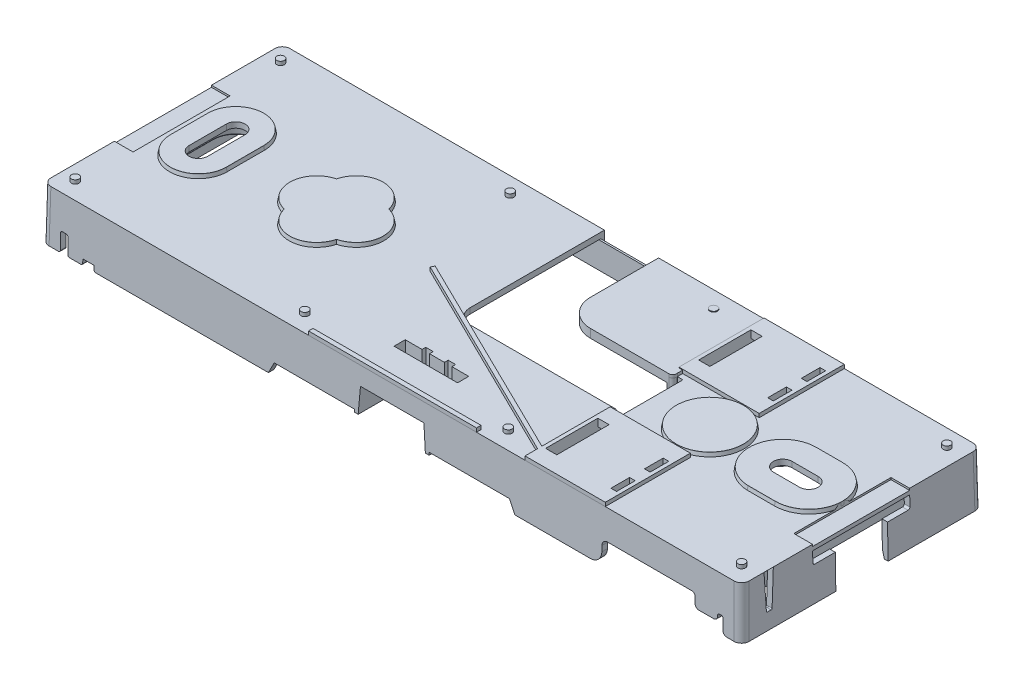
SolidWorks part; units mm, degrees
ref_plane "Plan de face" through (0, 0, 0) normal (0, 0, 1) x (1, 0, 0)
ref_plane "Plan de dessus" through (0, 0, 0) normal (0, 1, 0) x (1, 0, 0)
ref_plane "Plan de droite" through (0, 0, 0) normal (1, 0, 0) x (0, 0, -1)
sketch "Esquisse1" plane through (0, 0, 0) normal (0, 1, 0) x (1, 0, 0)
  line L1 (-93.75, 32.25) -> (93.75, 32.25)
  line L2 (-93.75, 32.25) -> (-93.75, -32.25)
  line L3 (-93.75, -32.25) -> (93.75, -32.25)
  line L4 (93.75, 32.25) -> (93.75, -32.25)
  dimension "D1" = 187.5
  dimension "D2" = 93.75
  dimension "D3" = 64.5
  dimension "D4" = 32.25
extrude "Extrusion1" add sketch "Esquisse1" along normal blind 13.8
draft "Dépouille2" type of draft neutral plane draft angle 1 faces to draft 2 parameters "D1"=1
draft "Dépouille4" type of draft neutral plane draft angle 1 faces to draft 2 parameters "D1"=1
fillet "Congé1" radius 2
fillet "Congé2" radius 2
fillet "Congé3" radius 2
fillet "Congé4" radius 2
shell "Coque4" thickness 1.5
sketch "Esquisse2" plane through (0, 0, 0) normal (1, 0, 0) x (0, 0, -1)
  line L0 (0, 21.9085) -> (0, -7.1737) construction
  line L1 (-13, 12.3) -> (13, 12.3)
  line L2 (-30.0352, 12.3) -> (30.0352, 12.3) construction
  line L4 (-13, 12.3) -> (-13, 9)
  line L5 (-13, 9) -> (-7, 9)
  line L6 (-7, 9) -> (-7, 0)
  line L7 (-30.2503, 0) -> (30.2503, 0) construction
  line L8 (13, 12.3) -> (13, 9)
  line L9 (13, 9) -> (7, 9)
  line L10 (7, 9) -> (7, 0)
  line L11 (-7, 0) -> (7, 0)
  dimension "D1" = 26
  dimension "D2" = 13
  dimension "D3" = 14
  dimension "D4" = 7
  dimension "D5" = 9
  dimension "D6" = 9
extrude "Enlèv. mat.-Extru.1" cut sketch "Esquisse2" against normal mid plane 200
sketch "Esquisse3" plane through (93.7214, 1.6359, 0) normal (0.9998, 0.0175, 0) x (0, 0, -1)
  line L0 (-26.0091, 12.1659) -> (-25.5091, 2.6659)
  line L1 (-30.0094, 12.1659) -> (30.0094, 12.1659) construction
  line L2 (-25.5091, 2.6659) -> (-24.0091, 2.6659)
  line L3 (-24.0091, 2.6659) -> (-23.5091, 12.1659)
  line L4 (-26.0091, 12.1659) -> (-23.5091, 12.1659)
  dimension "D1" = 6
  dimension "D2" = 2.5
  dimension "D3" = 1.5
  dimension "D4" = 9.5
  dimension "D5" = 0.5
extrude "Enlèv. mat.-Extru.2" cut sketch "Esquisse3" against normal blind 1.5
fillet "Congé5" radius 0.25
fillet "Congé6" radius 0.25
sketch "Esquisse4" plane through (-93.7214, 1.6359, 0) normal (-0.9998, 0.0175, 0) x (0, 0, 1)
  line L0 (26.0092, 12.1659) -> (25.5092, 2.6659)
  line L2 (-30.0094, 12.1659) -> (30.0094, 12.1659) construction
  line L6 (25.5092, 2.6659) -> (24.0092, 2.6659)
  line L7 (24.0092, 2.6659) -> (23.5092, 12.1659)
  line L8 (23.5092, 12.1659) -> (26.0092, 12.1659)
  dimension "D1" = 6
  dimension "D2" = 0.5
  dimension "D3" = 9.5
  dimension "D4" = 1.5
  dimension "D5" = 2.5
extrude "Enlèv. mat.-Extru.3" cut sketch "Esquisse4" against normal blind 1.5
fillet "Congé7" radius 0.25
fillet "Congé8" radius 0.25
sketch "Esquisse5" plane through (0, 0, 0) normal (0, 0, 1) x (1, 0, 0)
  line L0 (88.75, 0) -> (88.75, 4.3)
  line L1 (-91.7503, 0) -> (91.7503, 0) construction
  line L2 (88.75, 4.3) -> (87.25, 4.3)
  line L3 (87.25, 4.3) -> (87.25, 2.5)
  line L4 (87.25, 2.5) -> (81.25, 2.5)
  line L5 (81.25, 2.5) -> (81.25, 6)
  line L6 (81.25, 6) -> (56.25, 6)
  line L7 (56.25, 6) -> (56.25, 0)
  line L8 (-91.5094, 13.8) -> (91.5094, 13.8) construction
  dimension "D1" = 5
  dimension "D2" = 1.5
  dimension "D3" = 6
  dimension "D4" = 25
  dimension "D5" = 7.8
  dimension "D6" = 11.3
  dimension "D7" = 4.3
extrude "Enlèv. mat.-Extru.4" cut sketch "Esquisse5" against normal through all and the other way through all
fillet "Congé9" radius 3
fillet "Congé10" radius 3
fillet "Congé11" radius 1.5
fillet "Congé12" radius 1.5
fillet "Congé13" radius 1
fillet "Congé14" radius 1
fillet "Congé15" radius 1
fillet "Congé16" radius 1
fillet "Congé17" radius 1
fillet "Congé18" radius 1
fillet "Congé19" radius 1
fillet "Congé20" radius 1
fillet "Congé21" radius 0.5
fillet "Congé22" radius 0.5
sketch "Esquisse6" plane through (0, 0, 0) normal (0, 0, 1) x (1, 0, 0)
  line L0 (0, -4.4225) -> (0, 25.4688) construction
  line L1 (-8.5, 9) -> (8.5, 9)
  line L2 (-91.5094, 13.8) -> (91.5094, 13.8) construction
  line L3 (-10, 2.3) -> (-9, 2.3)
  line L4 (-8.5, 9) -> (-9, 2.3)
  line L5 (8.5, 9) -> (9, 2.3)
  line L6 (9, 2.3) -> (10, 2.3)
  line L7 (10, 2.3) -> (10, 3)
  line L8 (10, 3) -> (31.5, 3)
  line L9 (31.5, 3) -> (33, 0)
  line L10 (-91.7503, 0) -> (53.25, 0) construction
  line L11 (-10, 2.3) -> (-10, 3)
  line L12 (-10, 3) -> (-31.5, 3)
  line L13 (-31.5, 3) -> (-33, 0)
  line L14 (-33, 0) -> (33, 0)
  dimension "D1" = 17
  dimension "D2" = 8.5
  dimension "D3" = 4.8
  dimension "D4" = 11.5
  dimension "D5" = 9
  dimension "D6" = 1
  dimension "D7" = 1
  dimension "D8" = 9
  dimension "D9" = 11.5
  dimension "D10" = 10.8
  dimension "D11" = 21.5
  dimension "D12" = 1.5
  dimension "D13" = 10.8
  dimension "D14" = 21.5
  dimension "D15" = 1.5
extrude "Enlèv. mat.-Extru.5" cut sketch "Esquisse6" along normal blind 42.5
sketch "Esquisse8" plane through (0, 0, 0) normal (0, 0, 1) x (1, 0, 0)
  line L0 (-88.75, 0) -> (-88.75, 5)
  line L1 (-91.7503, 0) -> (-33, 0) construction
  line L2 (-88.75, 5) -> (-86.75, 5)
  line L3 (-86.75, 5) -> (-86.75, 0)
  line L4 (-82.75, 0) -> (-82.75, 1.5)
  line L5 (-82.75, 1.5) -> (-79.75, 1.5)
  line L6 (-79.75, 1.5) -> (-79.75, 0)
  line L7 (-86.75, 0) -> (-82.75, 0)
  line L8 (-88.75, 0) -> (-84.2317, -2.6338)
  line L9 (-84.2317, -2.6338) -> (-79.75, 0)
  dimension "D1" = 5
  dimension "D2" = 2
  dimension "D3" = 2
  dimension "D4" = 5
  dimension "D5" = 4
  dimension "D6" = 3
  dimension "D7" = 5
  dimension "D8" = 1.5
extrude "Enlèv. mat.-Extru.7" cut sketch "Esquisse8" against normal mid plane 200 contours L0 L2 L3 L7 L4 L5 L6 L9 L8
fillet "Congé23" radius 0.5
fillet "Congé24" radius 0.5
sketch "Esquisse9" plane through (0, 0, 0) normal (0, 0, 1) x (1, 0, 0)
  line L0 (-36.75, 0) -> (-35.25, 7.3)
  line L1 (-79.25, 0) -> (-33, 0) construction
  line L2 (-35.25, 7.3) -> (-32.25, 7.3)
  line L3 (-32.25, 7.3) -> (-32.25, 5.1)
  line L4 (-32.25, 5.1) -> (32.75, 5.1)
  line L5 (32.75, 5.1) -> (32.75, 6.1)
  line L6 (32.75, 6.1) -> (39.75, 6.1)
  line L7 (39.75, 6.1) -> (39.75, 0)
  line L8 (33, 0) -> (53.25, 0) construction
  line L9 (-91.5094, 13.8) -> (91.5094, 13.8) construction
  line L10 (-36.75, 0) -> (39.75, 0)
  dimension "D1" = 57
  dimension "D2" = 1.5
  dimension "D3" = 3
  dimension "D4" = 65
  dimension "D5" = 7
  dimension "D6" = 8.7
  dimension "D7" = 6.5
  dimension "D8" = 1
extrude "Enlèv. mat.-Extru.8" cut sketch "Esquisse9" against normal blind 200
sketch "Esquisse10" plane through (0, 0, 0) normal (0, 0, 1) x (1, 0, 0)
  line L0 (0, -4.4225) -> (0, 26.6766) construction
  line L1 (-91.5352, 12.3) -> (91.5352, 12.3) construction
  line L2 (-88.25, 12.3) -> (-87.25, 12.3)
  line L3 (-88.25, 12.3) -> (-88.25, 5)
  line L4 (-88.25, 5) -> (-87.25, 5)
  line L5 (-87.25, 12.3) -> (-87.25, 5)
  line L6 (88.25, 12.3) -> (87.25, 12.3)
  line L7 (87.25, 12.3) -> (87.25, 5)
  line L8 (88.25, 12.3) -> (88.25, 5)
  line L9 (88.25, 5) -> (87.25, 5)
  dimension "D1" = 1
  dimension "D2" = 7.3
  dimension "D3" = 7.3
  dimension "D4" = 88.25
extrude "Extrusion2" add sketch "Esquisse10" along normal mid plane 63
fillet "Congé25" radius 0.5
fillet "Congé26" radius 0.5
sketch "Esquisse11" plane through (0, 0, 0) normal (0, 0, 1) x (1, 0, 0)
  line L0 (0, 0) -> (0, 35.4326) construction
  line L1 (-87.25, 12.3) -> (87.25, 12.3) construction
  line L2 (-35.4, 12.3) -> (-34.2, 12.3)
  line L3 (-35.4, 12.3) -> (-35.4, 6.3)
  line L4 (-35.4, 6.3) -> (-34.2, 6.3)
  line L5 (-34.2, 12.3) -> (-34.2, 6.3)
  dimension "D1" = 1.2
  dimension "D2" = 24.2
  dimension "D3" = 6
  dimension "D4" = 6
extrude "Extrusion3" add sketch "Esquisse11" along normal mid plane 63
sketch "Esquisse12" plane through (0, 0, 0) normal (0, 0, 1) x (1, 0, 0)
  line L0 (0, 0) -> (0, 31.5075) construction
  line L1 (10, 3) -> (10, 2.3) construction
  line L2 (35, 12.3) -> (36.5, 12.3)
  line L3 (35, 12.3) -> (35, 0)
  line L4 (35, 0) -> (36.5, 0)
  line L5 (36.5, 12.3) -> (36.5, 0)
  line L6 (-34.2, 12.3) -> (87.25, 12.3) construction
  dimension "D1" = 25
  dimension "D2" = 1.5
  dimension "D3" = 12.3
  dimension "D4" = 12.3
extrude "Extrusion4" add sketch "Esquisse12" along normal mid plane 63
sketch "Esquisse13" plane through (-34.2, 0, 0) normal (1, 0, 0) x (0, 0, -1)
  line L0 (31.5, 7.3) -> (18.1223, 7.3)
  line L1 (18.1223, 7.3) -> (18.1223, 8.8)
  line L2 (18.1223, 8.8) -> (8.6416, 8.8)
  line L4 (-30.6398, 6.3) -> (31.5, 6.3) construction
  line L5 (8.6416, 8.8) -> (8.6416, 3.9431)
  line L6 (30.6608, 5.1) -> (30.6223, 7.3) construction
  line L7 (8.6416, 3.9431) -> (31.5, 3.9431)
  line L8 (31.5, 3.9431) -> (31.5, 7.3)
  point P8 (30.6416, 6.2)
  dimension "D1" = 2.5
  dimension "D2" = 12.5
  dimension "D3" = 22
extrude "Enlèv. mat.-Extru.11" cut sketch "Esquisse13" against normal blind 1.2
fillet "Congé27" radius 0.5
fillet "Congé28" radius 1
sketch "Esquisse15" plane through (0, 13.8, 0) normal (0, 1, 0) x (-1, 0, 0)
  line L0 (-104.5219, 0) -> (103.7404, 0) construction
  line L1 (0, -45.7161) -> (0, 65.2529) construction
  line L2 (-101.7867, 27.5) -> (100.6145, 27.5) construction
  line L3 (-89.0091, 17.4132) -> (-89.0091, 39.1061) construction
  line L6 (-93.5091, 23.5091) -> (-93.5091, -30.0094) construction
  line L7 (-26.5091, 19.7772) -> (-26.5091, 34.5172) construction
  line L8 (27.9909, 19.7772) -> (27.9909, 36.3249) construction
  line L9 (89.4909, 17.4132) -> (89.4909, 39.1061) construction
  circle A0 centre (-89.0091, 27.5) radius 1
  circle A1 centre (-26.5091, 27.5) radius 1
  circle A2 centre (27.9909, 27.5) radius 1
  circle A3 centre (89.4909, 27.5) radius 1
  circle A4 centre (-89.0091, -27.5) radius 1
  circle A5 centre (-26.5091, -27.5) radius 1
  circle A6 centre (27.9909, -27.5) radius 1
  circle A7 centre (89.4909, -27.5) radius 1
  dimension "D6" = 2
  dimension "D7" = 2
  dimension "D8" = 2
  dimension "D9" = 2
  dimension "D1" = 27.5
  dimension "D2" = 4.5
  dimension "D3" = 62.5
  dimension "D4" = 54.5
  dimension "D5" = 61.5
extrude "Extrusion6" add sketch "Esquisse15" along normal blind 1
sketch "Esquisse16" plane through (0, 13.8, 0) normal (0, 1, 0) x (-1, 0, 0)
  line L0 (0, -44.5439) -> (0, 38.6829) construction
  line L1 (-7.25, -35.1017) -> (-7.25, 3.2822) construction
  line L2 (7.25, -37.3832) -> (7.25, 14.69) construction
  line L3 (5.7803, 0) -> (-47.7692, 0) construction
  line L4 (-47.7692, -6.5351) -> (-9.5195, -6.5351) construction
  line L5 (-48.7086, 7.9649) -> (13.1619, 7.9649) construction
  line L6 (-35, -30.5351) -> (34.2, -30.5351) construction
  line L7 (-7.25, -32.0091) -> (-7.25, -6.5351)
  line L8 (-91.5094, -32.0091) -> (91.5094, -32.0091) construction
  line L9 (-7.25, -32.0091) -> (7.25, -32.0091)
  line L10 (7.25, -32.0091) -> (7.25, 7.9649)
  line L11 (-36.5, -17.3861) -> (-36.5, 15.6294) construction
  line L12 (-36.5, 30.5351) -> (-36.5, -30.5351) construction
  line L13 (-7.25, -6.5351) -> (-35, -6.5351)
  line L14 (-35, 30.5351) -> (-35, -30.5351) construction
  line L15 (-35, -6.5351) -> (-35, 7.9649)
  line L20 (-35, 7.9649) -> (7.25, 7.9649)
  dimension "D1" = 14.5
  dimension "D2" = 7.25
  dimension "D3" = 14.5
  dimension "D4" = 24
extrude "Enlèv. mat.-Extru.13" cut sketch "Esquisse16" against normal blind 1.5
sketch "Esquisse17" plane through (36.5, 0, 0) normal (1, 0, 0) x (0, 0, -1)
  line L0 (-7.9649, 13.05) -> (-7.9649, -2.8307) construction
  line L1 (-7.9649, 12.3) -> (-7.9649, 13.8) construction
  line L2 (6.5351, 13.05) -> (6.5351, -5.635) construction
  line L3 (6.5351, 12.3) -> (6.5351, 13.8) construction
  line L4 (-14.3333, 8.25) -> (14.2295, 8.25) construction
  line L5 (7, 0) -> (30.2503, 0) construction
  line L6 (-11.4251, 1) -> (11.0097, 1) construction
  line L7 (-7.9649, 8.25) -> (-7.9649, 12.3)
  line L8 (-7.9649, 12.3) -> (6.5351, 12.3)
  line L10 (6.5351, 12.3) -> (6.5351, 8.25)
  arc A0 (-7.9649, 8.25) -> (6.5351, 8.25) centre (-0.7149, 8.25) ccw
  dimension "D2" = 1
  dimension "D3" = 7.25
  dimension "D1" = 8.25
extrude "Enlèv. mat.-Extru.16" cut sketch "Esquisse17" against normal blind 2 contours A0 L10 L8 L7
sketch "Esquisse18" plane through (0, 12.3, 0) normal (0, -1, 0) x (1, 0, 0)
  line L0 (38, 10.4091) -> (38, -9.0348) construction
  line L1 (38, 9.2149) -> (38, -7.7851)
  line L2 (38, -7.7851) -> (36.5, -7.7851)
  line L3 (36.5, 30.7498) -> (36.5, -31.5) construction
  line L4 (36.5, -7.7851) -> (36.5, -6.5351)
  line L5 (36.5, -6.5351) -> (35, -6.5351)
  line L6 (35, -6.5351) -> (35, 7.9649)
  line L7 (35, 7.9649) -> (36.5, 7.9649)
  line L8 (38, 9.2149) -> (36.5, 9.2149)
  line L9 (36.5, 9.2149) -> (36.5, 7.9649)
  dimension "D1" = 17
  dimension "D2" = 1.25
  dimension "D3" = 1.5
extrude "Enlèv. mat.-Extru.17" cut sketch "Esquisse18" against normal blind 2
fillet "Congé29" radius 4
fillet "Congé30" radius 7.25
fillet "Congé31" radius 1
sketch "Esquisse19" plane through (0, 13.8, 0) normal (0, 1, 0) x (-1, 0, 0)
  line L0 (91.5094, 32.0091) -> (-91.5094, 32.0091) construction
  line L1 (-57, 9.2149) -> (-35.5, 9.2149)
  line L2 (-57, 9.2149) -> (-57, 32.0091)
  line L3 (-57, 32.0091) -> (-35.5, 32.0091)
  line L4 (-35.5, 9.2149) -> (-35.5, 32.0091)
  line L5 (-37.0326, 9.2149) -> (-39.783, 9.2149) construction
  line L6 (-36.5, 9.2149) -> (-38, 9.2149) construction
  line L7 (-36.5, 8.9649) -> (-36.5, 0.7149) construction
  line L8 (-7.6194, 0) -> (-99.4423, 0) construction
  line L9 (-57, -32.0091) -> (-35.5, -32.0091)
  line L10 (-35.5, -9.2149) -> (-35.5, -32.0091)
  line L11 (-57, -9.2149) -> (-57, -32.0091)
  line L12 (-57, -9.2149) -> (-35.5, -9.2149)
  dimension "D1" = 22.7942
  dimension "D2" = 21.5
  dimension "D3" = 1
extrude "Extrusion7" add sketch "Esquisse19" along normal blind 1
sketch "Esquisse20" plane through (0, 13.8, 0) normal (0, 1, 0) x (-1, 0, 0)
  line L0 (0, 0) -> (-76.3289, 0) construction
  line L1 (-53, -19.72) -> (-53, 18.6881) construction
  line L2 (-38, 9.2149) -> (-38, -7.7851) construction
  circle A0 centre (-53, 0) radius 9
  dimension "D2" = 18
  dimension "D1" = 15
extrude "Extrusion8" add sketch "Esquisse20" along normal blind 1
sketch "Esquisse21" plane through (0, 14.8, 0) normal (0, 1, 0) x (-1, 0, 0)
  line L0 (0, 0) -> (-84.2036, 0) construction
  line L1 (-36.5, -7.7851) -> (-36.5, -30.5351) construction
  line L2 (-39.5, -27.5) -> (-36.5, -27.5)
  line L3 (-39.5, -27.5) -> (-39.5, -13.5)
  line L4 (-39.5, -13.5) -> (-36.5, -13.5)
  line L5 (-36.5, -27.5) -> (-36.5, -13.5)
  line L6 (-39.5, 13.5) -> (-36.5, 13.5)
  line L7 (-39.5, 27.5) -> (-39.5, 13.5)
  line L8 (-36.5, 27.5) -> (-36.5, 13.5)
  line L9 (-39.5, 27.5) -> (-36.5, 27.5)
  dimension "D1" = 14
  dimension "D2" = 3
  dimension "D3" = 13.5
  dimension "D4" = 3
extrude "Enlèv. mat.-Extru.18" cut sketch "Esquisse21" against normal through all
sketch "Esquisse22" plane through (0, 14.8, 0) normal (0, 1, 0) x (-1, 0, 0)
  line L0 (-68.7483, 0) -> (-25.6869, 0) construction
  line L1 (-57, -9.2149) -> (-57, -32.0091) construction
  line L2 (-56, -28) -> (-54.5, -28)
  line L3 (-56, -28) -> (-56, -23)
  line L4 (-56, -23) -> (-54.5, -23)
  line L5 (-54.5, -28) -> (-54.5, -23)
  line L6 (-56, -19) -> (-54.5, -19)
  line L7 (-56, -19) -> (-56, -14)
  line L8 (-56, -14) -> (-54.5, -14)
  line L9 (-54.5, -19) -> (-54.5, -14)
  line L10 (-56, 14) -> (-54.5, 14)
  line L11 (-54.5, 19) -> (-54.5, 14)
  line L12 (-56, 19) -> (-56, 14)
  line L13 (-56, 19) -> (-54.5, 19)
  line L14 (-56, 23) -> (-54.5, 23)
  line L15 (-54.5, 28) -> (-54.5, 23)
  line L16 (-56, 28) -> (-56, 23)
  line L17 (-56, 28) -> (-54.5, 28)
  dimension "D1" = 14
  dimension "D2" = 5
  dimension "D3" = 4
  dimension "D4" = 5
  dimension "D5" = 1.5
  dimension "D6" = 1.5
  dimension "D7" = 1
  dimension "D8" = 1
extrude "Enlèv. mat.-Extru.19" cut sketch "Esquisse22" against normal through all
fillet "Congé34" radius 3
sketch "Esquisse23" plane through (36.5, 0, 0) normal (1, 0, 0) x (0, 0, -1)
  line L0 (0, 0) -> (0, 16.676) construction
  line L1 (-0.7149, 0) -> (31.5, 0) construction
  line L2 (28, 0) -> (13, 0)
  line L3 (28, 0) -> (28, 4)
  line L4 (28, 4) -> (13, 4)
  line L5 (13, 0) -> (13, 4)
  line L6 (-13, 0) -> (-13, 4)
  line L7 (-28, 4) -> (-13, 4)
  line L8 (-28, 0) -> (-13, 0)
  line L9 (-28, 0) -> (-28, 4)
  dimension "D1" = 13
  dimension "D2" = 28
  dimension "D3" = 4
  dimension "D4" = 4
extrude "Extrusion9" add sketch "Esquisse23" along normal blind 3
sketch "Esquisse24" plane through (0, 0, -28) normal (0, 0, -1) x (-1, 0, 0)
  line L0 (-36.5, 0) -> (-39.5, 2.5)
  line L1 (-39.5, 0) -> (-39.5, 4) construction
  line L2 (-39.5, 2.5) -> (-39.5, 0)
  line L3 (-39.5, 0) -> (-36.5, 0)
  line L4 (-36.5, 4) -> (-39.5, 3)
  line L5 (-39.5, 3) -> (-39.5, 4)
  line L6 (-39.5, 4) -> (-36.5, 4)
  dimension "D1" = 2.5
  dimension "D2" = 1
extrude "Enlèv. mat.-Extru.20" cut sketch "Esquisse24" against normal blind 57
sketch "Esquisse25" plane through (35, 0, 0) normal (-1, 0, 0) x (0, 0, 1)
  line L0 (34.1431, 1.5) -> (-33.4306, 1.5) construction
  line L1 (30.7498, 0) -> (-31.5, 0) construction
  line L2 (29.4523, 10) -> (-28.3937, 10) construction
  line L3 (13.125, -3.2449) -> (13.125, 12.3) construction
  line L4 (30.5351, 12.3) -> (7.9649, 12.3) construction
  line L5 (-13.125, -4.0437) -> (-13.125, 12.3) construction
  line L6 (-28.25, -4.0437) -> (-28.25, 11.2653) construction
  line L7 (28.25, -4.0437) -> (28.25, 11.2653) construction
  line L8 (0, 0) -> (0, 15.8873) construction
  line L9 (-32.063, 5.3169) -> (-26.7317, 5.3169) construction
  line L10 (13.625, 10) -> (12.625, 10)
  line L11 (12.625, 10) -> (12.375, 1.5)
  line L12 (13.625, 10) -> (13.875, 0)
  line L13 (12.375, 1.5) -> (5.4583, 1.5)
  line L14 (29, 1.5) -> (28.5, 10)
  line L15 (28.5, 10) -> (27.5, 10)
  line L16 (27.5, 10) -> (27.5, 0)
  line L17 (29, 1.5) -> (30.6947, 1.5)
  line L18 (30.6947, 1.5) -> (30.6947, -1.7229)
  line L19 (27.5, 0) -> (13.875, 0)
  line L20 (-12.375, 1.5) -> (-12.625, 10)
  line L21 (-12.625, 10) -> (-13.625, 10)
  line L22 (-13.625, 10) -> (-13.875, 0)
  line L24 (-4.0285, 1.5) -> (-12.375, 1.5)
  line L25 (-27.5, 0) -> (-27.75, 10)
  line L26 (-27.75, 10) -> (-28.75, 10)
  line L27 (-13.875, 0) -> (-27.5, 0)
  line L28 (-30.6433, 6.1) -> (-25.0711, 6.1) construction
  line L29 (-28.75, 10) -> (-29, 6.1)
  line L30 (-29, 6.1) -> (-34.8945, 6.1)
  line L31 (-34.8945, 6.1) -> (-34.8945, -2.896)
  line L32 (-34.8945, -2.896) -> (30.6947, -1.7229)
  arc A0 (5.4583, 1.5) -> (-4.0285, 1.5) centre (0.7149, 8.25) cw
  dimension "D15" = 8.25
  dimension "D1" = 1.5
  dimension "D2" = 10
  dimension "D3" = 26.25
  dimension "D4" = 13.125
  dimension "D5" = 56.5
  dimension "D6" = 28.25
  dimension "D7" = 0.5
  dimension "D8" = 1
  dimension "D9" = 0.75
  dimension "D10" = 0.75
  dimension "D11" = 0.5
  dimension "D12" = 1
  dimension "D13" = 0.75
  dimension "D14" = 0.75
  dimension "D16" = 0.5
  dimension "D17" = 1
  dimension "D18" = 0.75
  dimension "D19" = 0.75
  dimension "D20" = 0.5
  dimension "D21" = 0.5
  dimension "D22" = 0.75
  dimension "D23" = 0.75
extrude "Enlèv. mat.-Extru.21" cut sketch "Esquisse25" against normal blind 4.5
fillet "Congé35" radius 0.5
fillet "Congé36" radius 0.5
sketch "Esquisse26" plane through (36.5, 0, 0) normal (1, 0, 0) x (0, 0, -1)
  line L1 (0, 0) -> (0, 20.1944) construction
  line L2 (-13.5, 12.3) -> (-9.2149, 12.3) construction
  line L3 (-9.2149, 1.5) -> (-10.4149, 1.5)
  line L4 (-9.2149, 1.5) -> (-9.2149, 12.3)
  line L6 (-9.2149, 12.3) -> (-10.4149, 12.3)
  line L9 (-10.4149, 1.5) -> (-10.4149, 12.3)
  line L10 (9.2149, 1.5) -> (10.4149, 1.5)
  line L11 (10.4149, 1.5) -> (10.4149, 12.3)
  line L12 (9.2149, 1.5) -> (9.2149, 12.3)
  line L13 (9.2149, 12.3) -> (10.4149, 12.3)
  dimension "D1" = 1.2
  dimension "D2" = 10.8
  dimension "D3" = 10.8
  dimension "D4" = 1.2
extrude "Extrusion10" add sketch "Esquisse26" along normal blind 10.3
fillet "Congé37" radius 3
sketch "Esquisse28" plane through (0, 12.3, 0) normal (0, -1, 0) x (1, 0, 0)
  line L0 (0, 0) -> (82.6407, 0) construction
  line L1 (82.6407, 0) -> (22.4673, 0) construction
  line L2 (52.9447, -4.2981) -> (52.9447, 4.2981) construction
  circle A1 centre (52.9447, 0) radius 7.25
  dimension "D1" = 14.5
extrude "Enlèv. mat.-Extru.23" cut sketch "Esquisse28" against normal blind 1
sketch "Esquisse29" plane through (0, 12.3, 0) normal (0, -1, 0) x (1, 0, 0)
  line L0 (0, 0) -> (75.589, 0) construction
  line L1 (56, 19) -> (56, 14) construction
  line L2 (58, 30.5351) -> (56.5, 30.5351)
  line L3 (58, 30.5351) -> (58, 10.5351)
  line L4 (58, 10.5351) -> (56.5, 10.5351)
  line L5 (56.5, 30.5351) -> (56.5, 10.5351)
  line L6 (36.5, 30.5351) -> (87.25, 30.5351) construction
  line L7 (58, -10.5351) -> (56.5, -10.5351)
  line L8 (56.5, -30.5351) -> (56.5, -10.5351)
  line L9 (58, -30.5351) -> (58, -10.5351)
  line L10 (58, -30.5351) -> (56.5, -30.5351)
  dimension "D1" = 1.5
  dimension "D2" = 0.5
  dimension "D3" = 20
  dimension "D4" = 20
extrude "Extrusion11" add sketch "Esquisse29" along normal blind 4
sketch "Esquisse31" plane through (0, 13.8, 0) normal (0, 1, 0) x (-1, 0, 0)
  line L0 (0, -45.3254) -> (0, 58.6104) construction
  line L1 (0, 0) -> (104.5219, 0) construction
  line L2 (93.5091, -30.0094) -> (93.5091, 23.5092) construction
  line L3 (88.5091, -13) -> (98.5091, -13)
  line L4 (88.5091, -13) -> (88.5091, 13)
  line L5 (88.5091, 13) -> (98.5091, 13)
  line L6 (98.5091, -13) -> (98.5091, 13)
  line L7 (-88.5091, 13) -> (-98.5091, 13)
  line L8 (-98.5091, -13) -> (-98.5091, 13)
  line L9 (-88.5091, -13) -> (-88.5091, 13)
  line L10 (-88.5091, -13) -> (-98.5091, -13)
  dimension "D1" = 26
  dimension "D2" = 13
  dimension "D3" = 5
  dimension "D4" = 10
extrude "Enlèv. mat.-Extru.25" cut sketch "Esquisse31" against normal blind 0.5
sketch "Esquisse32" plane through (0, 13.8, 0) normal (0, 1, 0) x (-1, 0, 0)
  line L0 (-36.5, -7.7851) -> (-36.5, -9.2149)
  line L1 (-36.5, -9.2149) -> (-35.5, -9.2149)
  line L2 (-35.5, -9.2149) -> (-35.5, -32.0091)
  line L3 (-35.5, -32.0091) -> (-7.25, -32.0091)
  line L4 (-14.5, -6.5351) -> (-35.5, -6.5351)
  line L5 (-7.25, -13.7851) -> (-7.25, -32.0091)
  arc A0 (-36.5, -7.7851) -> (-35.5, -6.5351) centre (-35.5, -7.5601) cw
  arc A1 (-7.25, -13.7851) -> (-14.5, -6.5351) centre (-14.5, -13.7851) ccw
extrude "Extrusion12" add sketch "Esquisse32" along normal blind 0.8
sketch "Esquisse33" plane through (0, 13.8, 0) normal (0, 1, 0) x (-1, 0, 0)
  line L0 (0, 0) -> (34.2, 0) construction
  line L1 (34.2, 30.5351) -> (34.2, -30.5351) construction
  line L2 (-38, 27.5) -> (-29.8854, 27.5) construction
  line L3 (-36.5, 27.5) -> (-39.5, 27.5) construction
  line L4 (10.7301, 0.0091) -> (24.0665, 0.0091) construction
  line L5 (91.5094, 32.0091) -> (-35.5, 32.0091) construction
  line L6 (-35.5, 27.5) -> (20.5798, 0)
  line L7 (-35.5, 9.2149) -> (-35.5, 32.0091) construction
  line L8 (20.5798, 0) -> (21.0486, 0.8833)
  line L9 (21.0486, 0.8833) -> (-35.5, 28.6508)
  line L10 (-35.5, 27.5) -> (-35.5, 28.6508)
  dimension "D1" = 32
  dimension "D2" = 1
  dimension "D3" = 62.4596
  dimension "D4" = 62.9983
  dimension "D5" = 0.8833
extrude "Extrusion13" add sketch "Esquisse33" along normal blind 1
sketch "Esquisse34" plane through (0, 13.8, 0) normal (0, 1, 0) x (-1, 0, 0)
  line L0 (0, 0) -> (0, 53.1401) construction
  line L1 (91.5094, 32.0091) -> (-35.5, 32.0091) construction
  line L2 (-22.5, 30.8091) -> (22.5, 30.8091)
  line L3 (-22.5, 30.8091) -> (-22.5, 32.0091)
  line L4 (-22.5, 32.0091) -> (22.5, 32.0091)
  line L5 (22.5, 30.8091) -> (22.5, 32.0091)
  dimension "D1" = 45
  dimension "D2" = 22.5
  dimension "D3" = 1.2
  dimension "D4" = 1.2
extrude "Extrusion14" add sketch "Esquisse34" along normal blind 1
sketch "Esquisse35" plane through (0, 13.8, 0) normal (0, 1, 0) x (-1, 0, 0)
  line L0 (0, 0) -> (96.2898, 0) construction
  line L1 (79.0091, -25.9426) -> (79.0091, 26.7309) construction
  line L2 (93.5091, 13) -> (93.5091, 23.5092) construction
  line L3 (71.5091, -5) -> (71.5091, 5)
  line L4 (86.5091, -5) -> (86.5091, 5)
  arc A0 (71.5091, -5) -> (86.5091, -5) centre (79.0091, -5) ccw
  arc A1 (71.5091, 5) -> (86.5091, 5) centre (79.0091, 5) cw
  dimension "D6" = 7.5
  dimension "D7" = 7.5
  dimension "D1" = 14.5
  dimension "D2" = 10
  dimension "D3" = 5
  dimension "D4" = 7.5
  dimension "D5" = 15
  dimension "D8" = 10
  dimension "D9" = 10
extrude "Extrusion15" add sketch "Esquisse35" along normal blind 1
sketch "Esquisse36" plane through (0, 13.8, 0) normal (0, 1, 0) x (-1, 0, 0)
  line L0 (0, 0) -> (103.7404, 0) construction
  line L1 (40.0091, -14.8018) -> (40.0091, 16.6481) construction
  line L2 (34.5091, -6.7269) -> (34.5091, 6.7315) construction
  line L4 (54.0091, -14.8018) -> (54.0091, 16.6481) construction
  line L5 (59.5091, -5.7352) -> (59.5091, 5.3148) construction
  line L6 (33.122, -7) -> (62.7303, -7) construction
  line L7 (33.122, 7) -> (60.6053, 7) construction
  line L8 (42.4719, 12.5) -> (53.6636, 12.5) construction
  line L9 (37.9386, -12.5) -> (53.6636, -12.5) construction
  line L10 (93.5091, 13) -> (93.5091, 23.5092) construction
  arc A0 (40.0091, -7) -> (54.0091, -7) centre (47.0091, -5.2955) ccw
  arc A1 (40.0091, -7) -> (40.0091, 7) centre (41.7137, 0) cw
  arc A2 (40.0091, 7) -> (54.0091, 7) centre (47.0091, 5.2955) cw
  arc A3 (54.0091, 7) -> (54.0091, -7) centre (52.3046, 0) cw
  point P19 (93.5091, 18.2546)
  dimension "D9" = 7.2045
  dimension "D10" = 7.2045
  dimension "D1" = 14
  dimension "D2" = 14
  dimension "D3" = 7
  dimension "D4" = 25
  dimension "D5" = 12.5
  dimension "D6" = 34
  dimension "D7" = 25
  dimension "D8" = 5.5
extrude "Extrusion16" add sketch "Esquisse36" along normal blind 1
chamfer "Chanfrein1" distance 0.2 angle 78
chamfer "Chanfrein2" distance 0.2 angle 78
chamfer "Chanfrein3" distance 0.2 angle 78
chamfer "Chanfrein4" distance 0.2 angle 78
sketch "Esquisse37" plane through (0, 13.8, 0) normal (0, 1, 0) x (-1, 0, 0)
  line L0 (0, 0) -> (-102.9589, 0) construction
  line L1 (-79.5178, -9) -> (-72.5178, -9)
  line L2 (-79.5178, 9) -> (-72.2328, 9)
  line L3 (-93.5178, 13) -> (-93.5178, -13) construction
  arc A0 (-79.5178, -9) -> (-79.5178, 9) centre (-79.5178, 0) cw
  arc A1 (-72.5178, -9) -> (-72.2328, 9) centre (-72.5178, 0.0023) ccw
  dimension "D5" = 9.0023
  dimension "D1" = 7
  dimension "D2" = 18
  dimension "D3" = 9
  dimension "D4" = 14
extrude "Extrusion17" add sketch "Esquisse37" along normal blind 1
chamfer "Chanfrein5" distance 0.2 angle 78
sketch "Esquisse38" plane through (0, 12.3, 0) normal (0, -1, 0) x (1, 0, 0)
  line L0 (0, 0) -> (-94.2888, 0) construction
  line L1 (-35.4, -30.5351) -> (-87.25, 30.5351) construction
  line L2 (-35.4, 30.5351) -> (-87.25, -30.5351) construction
  line L7 (-84.9808, -28.6344) -> (-34.7138, 30.5351) construction
  line L8 (-34.7138, 30.5351) -> (-87.0662, -31.1136)
  line L9 (-85.7251, -27.9665) -> (-35.4, 31.3226) construction
  line L10 (-34.7138, 30.5351) -> (-35.4, 31.3226)
  line L11 (-35.4, 31.3226) -> (-87.9298, -30.5351)
  line L12 (-87.9298, -30.5351) -> (-87.0662, -31.1136)
  line L13 (-85.3901, 29.117) -> (-34.7138, -30.5351) construction
  line L14 (-36.7868, -29.6742) -> (-87.9298, 30.5351) construction
  dimension "D2" = 0.5
  dimension "D7" = 1
  dimension "D8" = 0.5
extrude "Extrusion18" add sketch "Esquisse38" along normal blind 4
sketch "Esquisse39" plane through (0, 12.3, 0) normal (0, -1, 0) x (1, 0, 0)
  line L0 (-35.4, -30.5351) -> (-87.25, 30.5351) construction
  line L3 (-36.7074, -28.2227) -> (-87.7001, 31.8348) construction
  line L4 (-87.1285, 31.1616) -> (-34.744, -30.5351)
  line L5 (-37.4813, -28.8559) -> (-88.0994, 30.7436) construction
  line L6 (-87.1285, 31.1616) -> (-88.0994, 30.7436)
  line L7 (-88.0994, 30.7436) -> (-35.5144, -31.1892)
  line L8 (-35.5144, -31.1892) -> (-34.744, -30.5351)
  dimension "D3" = 1
  dimension "D4" = 0.5
extrude "Extrusion19" add sketch "Esquisse39" along normal blind 4
sketch "Esquisse40" plane through (-36.0251, 0, -30.5877) normal (-0.7623, 0, -0.6472) x (-0.6472, 0, 0.7623)
  line L0 (39.7494, 12.6077) -> (39.7494, 8.5752) construction
  line L3 (-2.8944, 9.8) -> (86.6717, 9.8) construction
  line L4 (39.0819, 12.3) -> (0.069, 12.3) construction
  line L5 (36.2494, 11.1401) -> (36.2494, 7.2771) construction
  line L6 (24.2494, 11.1401) -> (24.2494, 7.2771) construction
  line L7 (39.0819, 8.3) -> (-0.0226, 8.3) construction
  line L8 (24.2494, 8.3) -> (24.2494, 7.0393)
  line L9 (24.2494, 7.0393) -> (36.2494, 7.0393)
  line L10 (36.2494, 7.0393) -> (36.2494, 8.3)
  arc A0 (24.2494, 8.3) -> (36.2494, 8.3) centre (30.2494, -2.95) cw
  dimension "D1" = 2.5
  dimension "D2" = 3.5
  dimension "D3" = 12
extrude "Enlèv. mat.-Extru.26" cut sketch "Esquisse40" against normal blind 2
sketch "Esquisse41" plane through (-35.2547, 0, -29.9336) normal (0.7623, 0, 0.6472) x (0.6472, 0, -0.7623)
  line L0 (-6.5323, 9.8) -> (-74.2574, 9.8) construction
  line L1 (-0.2245, 12.3) -> (-39.2479, 12.3) construction
  line L2 (-17.2494, 6.367) -> (-17.2494, 13.4502) construction
  line L3 (-5.2494, 5.9165) -> (-5.2494, 13.4502) construction
  line L4 (-0.2245, 8.3) -> (-24.2494, 8.3) construction
  line L5 (-5.2494, 8.3) -> (-5.2494, 6.7001)
  line L6 (-5.2494, 6.7001) -> (-17.2494, 6.7001)
  line L7 (-17.2494, 6.7001) -> (-17.2494, 8.3)
  line L8 (-43.2494, 6.7001) -> (-43.2494, 11.5876) construction
  line L9 (-55.2494, 6.2359) -> (-55.2494, 11.3109) construction
  line L10 (-62.2494, 6.7001) -> (-62.2494, 12.3) construction
  line L11 (-40.2945, 12.3) -> (-79.3249, 12.3) construction
  line L12 (-74.2494, 6.9132) -> (-74.2494, 11.5876) construction
  line L13 (-62.2494, 8.3) -> (-62.2494, 5.6082)
  line L14 (-62.2494, 5.6082) -> (-74.2494, 5.6082)
  line L15 (-74.2494, 5.6082) -> (-74.2494, 8.3)
  line L16 (-40.2945, 8.3) -> (-79.4165, 8.3) construction
  line L17 (-43.2494, 8.3) -> (-43.2494, 5.2645)
  line L18 (-43.2494, 5.2645) -> (-55.2494, 5.2645)
  line L19 (-55.2494, 5.2645) -> (-55.2494, 8.3)
  arc A0 (-5.2494, 8.3) -> (-17.2494, 8.3) centre (-11.2494, -2.95) ccw
  arc A1 (-62.2494, 8.3) -> (-74.2494, 8.3) centre (-68.2494, -2.95) ccw
  arc A2 (-43.2494, 8.3) -> (-55.2494, 8.3) centre (-49.2494, -2.95) ccw
  dimension "D8" = 12.75
  dimension "D9" = 12.75
  dimension "D1" = 2.5
  dimension "D2" = 12
  dimension "D3" = 7
  dimension "D4" = 7
  dimension "D5" = 12
  dimension "D6" = 7
  dimension "D7" = 12
extrude "Enlèv. mat.-Extru.27" cut sketch "Esquisse41" against normal blind 1.5
sketch "Esquisse42" plane through (-36.022, 0, 30.5901) normal (-0.7622, 0, 0.6473) x (0.6473, 0, 0.7622)
  line L0 (-39.7105, 12.5269) -> (-39.7105, 8.3548) construction
  line L1 (-36.2105, 4.8843) -> (-36.2105, 15.1871) construction
  line L2 (-24.2105, 3.1951) -> (-24.2105, 15.9168) construction
  line L3 (-17.2105, 2.1525) -> (-17.2105, 15.1871) construction
  line L4 (-5.2105, 2.1525) -> (-5.2105, 14.8001) construction
  line L5 (-43.2105, 3.1951) -> (-43.2105, 15.1871) construction
  line L6 (-55.2105, 3.1951) -> (-55.2105, 16.6604) construction
  line L7 (-62.2105, 2.1525) -> (-62.2105, 13.756) construction
  line L8 (-74.2105, 2.1525) -> (-74.2105, 13.756) construction
  line L9 (-72.9231, 9.8) -> (-10.9467, 9.8) construction
  line L10 (-0.0722, 12.3) -> (-39.1053, 12.3) construction
  line L11 (-40.1294, 8.3) -> (-79.1414, 8.3) construction
  line L12 (-62.2105, 8.3) -> (-62.2105, 4.4559)
  line L13 (-62.2105, 4.4559) -> (-74.2105, 4.4559)
  line L14 (-74.2105, 4.4559) -> (-74.2105, 8.3)
  line L15 (-43.2105, 8.3) -> (-43.2105, 4.8843)
  line L16 (-43.2105, 4.8843) -> (-55.2105, 4.8843)
  line L17 (-55.2105, 4.8843) -> (-55.2105, 8.3)
  line L19 (0.0194, 8.3) -> (-39.1053, 8.3) construction
  line L20 (-24.2105, 8.3) -> (-24.2105, 4.8843)
  line L21 (-24.2105, 4.8843) -> (-36.2105, 4.8843)
  line L22 (-36.2105, 4.8843) -> (-36.2105, 8.3)
  line L23 (-5.2105, 8.3) -> (-5.2105, 5.811)
  line L24 (-5.2105, 5.811) -> (-17.2105, 5.811)
  line L25 (-17.2105, 5.811) -> (-17.2105, 8.3)
  arc A0 (-62.2105, 8.3) -> (-74.2105, 8.3) centre (-68.2105, -2.95) ccw
  arc A1 (-43.2105, 8.3) -> (-55.2105, 8.3) centre (-49.2105, -2.95) ccw
  arc A2 (-24.2105, 8.3) -> (-36.2105, 8.3) centre (-30.2105, -2.95) ccw
  arc A3 (-5.2105, 8.3) -> (-17.2105, 8.3) centre (-11.2105, -2.95) ccw
  dimension "D10" = 12.75
  dimension "D1" = 2.5
  dimension "D2" = 3.5
  dimension "D3" = 12
  dimension "D4" = 7
  dimension "D5" = 12
  dimension "D6" = 3.5
  dimension "D7" = 12
  dimension "D8" = 7
  dimension "D9" = 12
extrude "Enlèv. mat.-Extru.28" cut sketch "Esquisse42" against normal blind 1.5
sketch "Esquisse43" plane through (0, 12.3, 0) normal (0, -1, 0) x (1, 0, 0)
  line L0 (-31.9386, 0) -> (-63.0393, 0) construction
  line L1 (-38.6595, 6) -> (-55.8571, 6) construction
  line L5 (-47.0091, 13.2429) -> (-47.0091, -10.5439) construction
  line L6 (-41.0091, 9.4212) -> (-41.0091, -12.1912) construction
  line L7 (-53.0091, 8.8281) -> (-53.0091, -13.4432) construction
  line L8 (-36.0091, -6) -> (-59.8765, -6) construction
  line L10 (-44.392, 11) -> (-49.3998, 11) construction
  line L11 (-36.0091, 1.3798) -> (-36.0091, -3.9574) construction
  line L12 (-46.1052, -11) -> (-48.8397, -11) construction
  line L13 (-58.0091, 1.3495) -> (-58.0091, -1.9122) construction
  arc A2 (-41.0091, 6) -> (-41.0091, -6) centre (-42.0887, 0) cw
  arc A3 (-53.0091, 6) -> (-53.0091, -6) centre (-51.9091, 0) ccw
  arc A4 (-41.0091, 6) -> (-53.0091, 6) centre (-47.0091, 4.9) ccw
  arc A5 (-41.0091, -6) -> (-53.0091, -6) centre (-47.0091, -4.9) cw
  dimension "D9" = 6.0963
  dimension "D1" = 6
  dimension "D2" = 6
  dimension "D3" = 6
  dimension "D4" = 6
  dimension "D5" = 11
  dimension "D6" = 11
  dimension "D7" = 11
  dimension "D8" = 11
extrude "Enlèv. mat.-Extru.29" cut sketch "Esquisse43" against normal blind 1
sketch "Esquisse44" plane through (0, 12.3, 0) normal (0, -1, 0) x (1, 0, 0)
  line L0 (-72.0091, 0) -> (-96.5514, 0) construction
  line L1 (-79.0091, 14.4797) -> (-79.0091, -17.3582) construction
  line L2 (-69.6528, 5) -> (-88.25, 5) construction
  line L3 (-88.25, 30.6625) -> (-88.25, -30.6625) construction
  line L4 (-69.6528, -5) -> (-90.4108, -5) construction
  line L5 (-72.0091, 5) -> (-72.0091, -5)
  line L8 (-72.0091, 12) -> (-86.0091, 12) construction
  line L9 (-86.0091, -5) -> (-86.0091, 5)
  line L10 (-70.8348, -12) -> (-85.0091, -12) construction
  line L11 (-70.9724, -12.162) -> (-63.2048, -3.0151) construction
  line L12 (-76.3274, 11) -> (-81.0663, 11) construction
  line L13 (-75.9269, -11) -> (-81.0663, -11) construction
  arc A0 (-72.0091, 5) -> (-86.0091, 5) centre (-79.0091, 5) ccw
  arc A1 (-72.0091, -5) -> (-86.0091, -5) centre (-79.0091, -5) cw
  dimension "D1" = 7
  dimension "D5" = 7
  dimension "D6" = 7
extrude "Extrusion20" add sketch "Esquisse44" along normal blind 3
chamfer "Chanfrein6" distance 0.2 angle 86
sketch "Esquisse45" plane through (0, 9.3, 0) normal (0, -1, 0) x (1, 0, 0)
  line L0 (-79.0091, 13.3012) -> (-79.0091, -13.257) construction
  line L1 (-86.7091, 5) -> (-70.4622, 5) construction
  line L2 (-86.9992, -5) -> (-70.4622, -5) construction
  line L3 (-75.9471, 11) -> (-80.8546, 11) construction
  line L4 (-75.3697, -11) -> (-80.8546, -11) construction
  line L5 (-73.0091, 5) -> (-73.0091, -5)
  line L6 (-85.0091, 5) -> (-85.0091, -5)
  line L7 (-72.0091, -5) -> (-72.0091, 5) construction
  line L8 (-86.0091, 5) -> (-86.0091, -5) construction
  arc A0 (-73.0091, 5) -> (-85.0091, 5) centre (-79.0091, 5) ccw
  arc A1 (-73.0091, -5) -> (-85.0091, -5) centre (-79.0091, -5) cw
  dimension "D1" = 1
  dimension "D2" = 1
  dimension "D3" = 6
  dimension "D4" = 6
extrude "Enlèv. mat.-Extru.30" cut sketch "Esquisse45" against normal blind 4
chamfer "Chanfrein7" distance 0.2 angle 87
fillet "Congé39" radius 0.25
sketch "Esquisse46" plane through (0, 13.3, 0) normal (0, -1, 0) x (1, 0, 0)
  line L0 (-72.5011, 5) -> (-85.256, 5) construction
  line L1 (-72.7622, -5) -> (-85.7662, -5) construction
  line L2 (-79.0091, 10.9972) -> (-79.0091, -10.9972) construction
  line L3 (-76.5091, 5) -> (-76.5091, -5)
  line L4 (-81.5091, 5) -> (-81.5091, -5)
  line L5 (-74.9236, 7.5) -> (-82.3085, 7.5) construction
  line L6 (-74.9236, -7.5) -> (-81.5091, -7.5) construction
  arc A0 (-85.7662, -5) -> (-72.252, -5) centre (-79.0091, -5) ccw construction
  arc A1 (-73.0119, 5) -> (-85.0063, 5) centre (-79.0091, 5) ccw construction
  arc A2 (-85.0063, -5) -> (-73.0119, -5) centre (-79.0091, -5) ccw construction
  arc A3 (-76.5091, 5) -> (-81.5091, 5) centre (-79.0091, 5) ccw
  arc A4 (-76.5091, -5) -> (-81.5091, -5) centre (-79.0091, -5) cw
  dimension "D1" = 2.5
  dimension "D2" = 2.5
  dimension "D3" = 2.5
  dimension "D4" = 2.5
extrude "Enlèv. mat.-Extru.31" cut sketch "Esquisse46" against normal blind 4
sketch "Esquisse47" plane through (0, 12.3, 0) normal (0, -1, 0) x (1, 0, 0)
  line L0 (57.9648, 0) -> (97.616, 0) construction
  line L1 (79.5178, 11.5522) -> (79.5178, -11.0765) construction
  line L2 (72.5178, -11.0765) -> (72.5178, 12.7754) construction
  line L3 (79.5178, 8.75) -> (72.5178, 8.75)
  line L4 (79.5178, -8.75) -> (72.5178, -8.75)
  arc A0 (79.5178, 8.75) -> (79.5178, -8.75) centre (79.5178, 0) cw
  arc A1 (72.5178, 8.75) -> (72.5178, -8.75) centre (72.5178, 0) ccw
  dimension "D1" = 8.75
  dimension "D2" = 17.5
extrude "Extrusion21" add sketch "Esquisse47" along normal blind 2.5
sketch "Esquisse48" plane through (0, 9.8, 0) normal (0, -1, 0) x (1, 0, 0)
  line L0 (62.947, 0) -> (88.5091, 0) construction
  line L1 (88.5091, -13) -> (88.5091, 13) construction
  line L2 (79.5178, 9.5272) -> (79.5178, -9.5602) construction
  line L3 (72.5178, 9.9951) -> (72.5178, -9.9344) construction
  line L4 (79.5178, 7.75) -> (72.5178, 7.75)
  line L5 (79.5178, -7.75) -> (72.5178, -7.75)
  line L6 (79.5178, 8.75) -> (72.5178, 8.75) construction
  line L7 (72.5178, -8.75) -> (79.5178, -8.75) construction
  arc A0 (72.5178, 7.75) -> (72.5178, -7.75) centre (72.5178, 0) ccw
  arc A1 (79.5178, 7.75) -> (79.5178, -7.75) centre (79.5178, 0) cw
  dimension "D1" = 1
  dimension "D2" = 1
extrude "Enlèv. mat.-Extru.32" cut sketch "Esquisse48" against normal blind 3.5
chamfer "Chanfrein8" distance 0.2 angle 86
fillet "Congé41" radius 0.25
sketch "Esquisse49" plane through (0, 13.3, 0) normal (0, -1, 0) x (1, 0, 0)
  line L0 (60.1947, 0) -> (89.7872, 0) construction
  line L1 (79.5178, 10.2175) -> (79.5178, -10.2728) construction
  line L2 (72.5178, 10.2175) -> (72.5178, -11.6282) construction
  line L3 (79.5178, 2.5) -> (72.5178, 2.5)
  line L4 (79.5178, -2.5) -> (72.5178, -2.5)
  circle A0 centre (52.9447, 0) radius 7.25 construction
  arc A1 (79.5178, 2.5) -> (79.5178, -2.5) centre (79.5178, 0) cw
  arc A2 (72.5178, 2.5) -> (72.5178, -2.5) centre (72.5178, 0) ccw
  dimension "D1" = 2.5
  dimension "D2" = 5
extrude "Enlèv. mat.-Extru.33" cut sketch "Esquisse49" against normal blind 3.5
sketch "Esquisse50" plane through (0, 12.3, 0) normal (0, -1, 0) x (1, 0, 0)
  line L0 (72.6456, 11.812) -> (72.6456, -12.6647) construction
  line L1 (51.0391, 0) -> (90.0264, 0) construction
  line L2 (87.25, -30.5351) -> (61.3731, 0.8052) construction
  line L3 (87.25, 30.6887) -> (61.9874, -0.4756) construction
  line L5 (65.5294, 3.8939) -> (62.3459, 2.8246) construction
  line L8 (61.8915, -1.3933) -> (85.7009, -30.2295) construction
  line L9 (85.7009, -30.2295) -> (61.2385, -0.6024) construction
  line L10 (62.2488, 1.4349) -> (86.4731, 31.3184) construction
  line L11 (65.5294, 3.8939) -> (64.7526, 4.5236)
  line L12 (65.5294, 3.8939) -> (87.5227, 31.0329)
  line L13 (87.5227, 31.0329) -> (86.4731, 31.3184)
  line L14 (86.4731, 31.3184) -> (64.7526, 4.5236)
  circle A0 centre (53, 0) radius 9 construction
  arc A1 (72.5178, 8) -> (72.5178, -8) centre (72.5178, 0) ccw construction
  dimension "D2" = 1
extrude "Extrusion22" add sketch "Esquisse50" along normal blind 3
sketch "Esquisse52" plane through (0, 12.3, 0) normal (0, -1, 0) x (1, 0, 0)
  line L0 (59.1105, 0) -> (74.8465, 0) construction
  line L1 (65.5294, 3.8939) -> (65.5294, -7.25) construction
  line L2 (87.25, -30.5351) -> (65.5294, -3.8939) construction
  line L3 (65.5294, -3.8939) -> (64.7544, -4.5258)
  line L4 (65.5294, -3.8939) -> (87.4908, -30.8161)
  line L5 (87.4908, -30.8161) -> (86.7159, -31.4482)
  line L6 (86.7159, -31.4482) -> (64.7544, -4.5258)
  arc A0 (65.5294, 3.8939) -> (72.5178, -8) centre (72.5178, 0) ccw construction
  dimension "D1" = 1
  dimension "D2" = 90
  dimension "D3" = 1
extrude "Extrusion24" add sketch "Esquisse52" along normal blind 3
sketch "Esquisse53" plane through (0, 12.3, 0) normal (0, -1, 0) x (1, 0, 0)
  line L0 (70.9917, 0) -> (56.095, 0) construction
  line L1 (64.2055, 0) -> (65.6047, 4.1259)
  line L2 (64.696, -4.4542) -> (65.0206, -4.8521)
  line L3 (64.7544, -4.5258) -> (86.0138, -30.5874) construction
  line L4 (64.6867, 4.4423) -> (65.0206, 4.8542)
  line L5 (64.2055, 0) -> (65.6924, -4.3565)
  line L6 (64.5827, 4.2158) -> (63.2587, 0.3219)
  line L7 (63.2587, -0.3219) -> (64.5827, -4.2158)
  line L8 (85.8806, 30.5874) -> (64.7526, 4.5236) construction
  line L9 (65.6924, -4.3565) -> (65.0206, -4.8521)
  line L10 (65.6047, 4.1259) -> (65.0206, 4.8542)
  arc A1 (63.2587, 0.3219) -> (63.2587, -0.3219) centre (64.2055, 0) ccw
  arc A2 (72.2328, 9) -> (72.5178, -9) centre (72.5178, 0.0023) ccw construction
  arc A3 (64.6867, 4.4423) -> (64.5827, 4.2158) centre (65.0769, 4.1259) ccw
  arc A4 (64.5827, -4.2158) -> (64.696, -4.4542) centre (65.6614, -3.849) ccw
extrude "Extrusion25" add sketch "Esquisse53" along normal blind 3
sketch "Esquisse54" plane through (0, 12.3, 0) normal (0, -1, 0) x (1, 0, 0)
  line L1 (64.7267, 1.3185) -> (64.1178, 1.3185)
  line L2 (64.7267, 1.3185) -> (64.7267, -1.3288)
  line L3 (64.7267, -1.3288) -> (64.1178, -1.3288)
  line L4 (64.1178, 1.3185) -> (64.1178, -1.3288)
extrude "Extrusion26" add sketch "Esquisse54" along normal blind 3
sketch "Esquisse55" plane through (0, 12.3, 0) normal (0, -1, 0) x (1, 0, 0)
  line L0 (54.8114, 0) -> (68.4272, 0) construction
  line L1 (58, 10.5351) -> (63.8254, 0)
  line L2 (63.8254, 0) -> (58, -10.5351)
  line L7 (58.0873, 8.3106) -> (62.6827, 0) construction
  line L8 (62.6827, 0) -> (56.8269, 10.5351)
  line L9 (56.5, 10.5351) -> (58, 10.5351) construction
  line L10 (56.8269, 10.5351) -> (58, 10.5351)
  line L11 (62.6827, 0) -> (56.7086, -10.8039) construction
  line L12 (62.6827, 0) -> (56.8269, -10.59)
  line L13 (56.8269, -10.59) -> (58, -10.5351)
extrude "Extrusion27" add sketch "Esquisse55" along normal blind 3
fillet "Congé42" radius 0.5
fillet "Congé43" radius 0.5
sketch "Esquisse56" plane through (0, 12.3, 0) normal (0, -1, 0) x (1, 0, 0)
  line L0 (58, 30.5351) -> (85.8382, 30.5351) construction
  line L1 (87.25, 30.6625) -> (87.25, -30.6625) construction
  circle A0 centre (82.75, 26.0351) radius 2.5
  dimension "D1" = 5
  dimension "D2" = 4.5
  dimension "D3" = 4.5
extrude "Extrusion28" add sketch "Esquisse56" along normal blind 8
draft "Dépouille5" type of draft neutral plane draft angle 1 faces to draft 1 parameters "D1"=1
sketch "Esquisse57" plane through (0, 4.3, 0) normal (0, -1, 0) x (1, 0, 0)
  line L0 (85.25, 26.0351) -> (79.3814, 26.0351) construction
  line L1 (82.7772, 23.1157) -> (82.7772, 28.9179) construction
  circle A0 centre (82.7772, 26.0168) radius 1.5
  circle A1 centre (82.75, 26.0351) radius 2.5 construction
  dimension "D1" = 3
extrude "Enlèv. mat.-Extru.34" cut sketch "Esquisse57" against normal blind 8
sketch "Esquisse58" plane through (0, 4.3, 0) normal (0, -1, 0) x (1, 0, 0)
  line L0 (85.1764, 28.1375) -> (81.184, 23.2111)
  line L1 (84.7763, 27.6439) -> (87.1617, 30.5874) construction
  line L2 (65.5294, 3.8939) -> (81.596, 23.7194) construction
  line L3 (81.184, 23.2111) -> (80.3558, 23.772)
  line L4 (80.8062, 24.3275) -> (64.6867, 4.4423) construction
  line L5 (80.3558, 23.772) -> (84.4857, 28.8666)
  line L6 (85.8806, 30.5874) -> (84.0184, 28.2901) construction
  line L7 (84.4857, 28.8666) -> (85.1764, 28.1375)
extrude "Enlèv. mat.-Extru.35" cut sketch "Esquisse58" against normal blind 5
fillet "Congé44" radius 0.25
sketch "Esquisse59" plane through (56.5, 0, 0) normal (-1, 0, 0) x (0, 0, 1)
  line L0 (0, 0) -> (0, 19.0916) construction
  line L1 (30.5351, 8.3) -> (30.5351, 12.3) construction
  line L2 (27.5351, 9.8) -> (22.5351, 9.8)
  line L3 (27.5351, 9.8) -> (27.5351, 11.3)
  line L4 (27.5351, 11.3) -> (22.5351, 11.3)
  line L5 (22.5351, 9.8) -> (22.5351, 11.3)
  line L6 (18.5351, 9.8) -> (13.5351, 9.8)
  line L7 (18.5351, 9.8) -> (18.5351, 11.3)
  line L8 (18.5351, 11.3) -> (13.5351, 11.3)
  line L9 (13.5351, 9.8) -> (13.5351, 11.3)
  line L10 (30.5351, 12.3) -> (10.5351, 12.3) construction
  line L11 (-13.5351, 9.8) -> (-13.5351, 11.3)
  line L12 (-18.5351, 11.3) -> (-13.5351, 11.3)
  line L13 (-18.5351, 9.8) -> (-13.5351, 9.8)
  line L14 (-18.5351, 9.8) -> (-18.5351, 11.3)
  line L15 (-22.5351, 9.8) -> (-22.5351, 11.3)
  line L16 (-27.5351, 11.3) -> (-22.5351, 11.3)
  line L17 (-27.5351, 9.8) -> (-22.5351, 9.8)
  line L18 (-27.5351, 9.8) -> (-27.5351, 11.3)
  point P11 (30.5351, 10.3)
  dimension "D1" = 5
  dimension "D2" = 3
  dimension "D3" = 4
  dimension "D4" = 5
  dimension "D5" = 1
  dimension "D6" = 1.5
  dimension "D7" = 1
  dimension "D8" = 1.5
extrude "Extrusion29" add sketch "Esquisse59" along normal blind 2.5
sketch "Esquisse63" plane through (0, 12.3, 0) normal (0, -1, 0) x (1, 0, 0)
  line L0 (0, 44.9346) -> (0, -62.5178) construction
  line L1 (67.2445, 0) -> (98.5079, 0) construction
  line L2 (88.25, 30.6625) -> (88.25, -30.6625) construction
  line L3 (92.839, 19.5) -> (88.25, 19.5)
  line L4 (92.839, 19.5) -> (92.839, 18.5)
  line L5 (92.839, 18.5) -> (88.25, 18.5)
  line L6 (88.25, 19.5) -> (88.25, 18.5)
  line L7 (88.25, -19.5) -> (88.25, -18.5)
  line L8 (92.839, -19.5) -> (92.839, -18.5)
  line L9 (92.839, -18.5) -> (88.25, -18.5)
  line L10 (92.839, -19.5) -> (88.25, -19.5)
  dimension "D1" = 1
  dimension "D2" = 19.5
extrude "Extrusion31" add sketch "Esquisse63" along normal blind 12.3
sketch "Esquisse64" plane through (0, 12.3, 0) normal (0, -1, 0) x (1, 0, 0)
  line L0 (-79.3146, 0) -> (-101.0978, 0) construction
  line L1 (-88.25, 30.6625) -> (-88.25, -30.6625) construction
  line L2 (-88.25, 19.5) -> (-92.838, 19.5)
  line L3 (-88.25, 19.5) -> (-88.25, 18.5)
  line L4 (-88.25, 18.5) -> (-92.838, 18.5)
  line L5 (-92.838, 19.5) -> (-92.838, 18.5)
  line L6 (-92.838, -19.5) -> (-92.838, -18.5)
  line L7 (-88.25, -18.5) -> (-92.838, -18.5)
  line L8 (-88.25, -19.5) -> (-88.25, -18.5)
  line L9 (-88.25, -19.5) -> (-92.838, -19.5)
  dimension "D1" = 1
  dimension "D2" = 19.5
extrude "Extrusion32" add sketch "Esquisse64" along normal blind 12.3
sketch "Esquisse65" plane through (0, 0, -19.5) normal (0, 0, -1) x (-1, 0, 0)
  line L0 (-88.25, 5) -> (-89.25, 5)
  line L1 (-89.25, 5) -> (-92.2498, 0)
  line L2 (-88.25, 5) -> (-88.25, 0)
  line L3 (-88.25, 0) -> (-92.2498, 0)
  dimension "D1" = 1
extrude "Enlèv. mat.-Extru.38" cut sketch "Esquisse65" against normal blind 40.3
sketch "Esquisse66" plane through (0, 0, -19.5) normal (0, 0, -1) x (-1, 0, 0)
  line L0 (88.25, 5) -> (89.25, 5)
  line L1 (89.25, 5) -> (92.2498, 0)
  line L2 (92.2498, 0) -> (88.25, 0)
  line L3 (88.25, 0) -> (88.25, 5)
  dimension "D1" = 1
extrude "Enlèv. mat.-Extru.39" cut sketch "Esquisse66" against normal blind 40.3
chamfer "Chanfrein9" distance 2 angle 14
chamfer "Chanfrein10" distance 2 angle 14
chamfer "Chanfrein13" distance 3 angle 30
chamfer "Chanfrein14" distance 3 angle 30
fillet "Congé46" radius 0.5
fillet "Congé47" radius 0.5
sketch "Esquisse67" plane through (0, 12.3, 0) normal (0, -1, 0) x (1, 0, 0)
  line L0 (0, 0) -> (0, 69.551) construction
  line L1 (10, 31.4597) -> (10, 13.2805) construction
  line L2 (10, 32.2099) -> (10, 30.7096) construction
  line L3 (8.5, 30.5927) -> (8.5, 12.2952) construction
  line L4 (14.289, 14.9884) -> (-12.1836, 14.9884) construction
  line L5 (-8.5, 31.3428) -> (-8.5, 12.2952) construction
  line L6 (-8.5, 32.0929) -> (-8.5, 30.5927) construction
  line L7 (8.5, 30.5927) -> (-8.5, 30.5927) construction
  line L8 (8.5, 20.0927) -> (-8.5, 20.0927)
  line L9 (8.5, 20.0927) -> (8.5, 23.0927)
  line L10 (8.5, 23.0927) -> (-8.5, 23.0927)
  line L11 (-8.5, 20.0927) -> (-8.5, 23.0927)
  dimension "D1" = 7.5
  dimension "D2" = 3
extrude "Enlèv. mat.-Extru.40" cut sketch "Esquisse67" against normal blind 40.3
sketch "Esquisse69" plane through (0, 12.3, 0) normal (0, -1, 0) x (1, 0, 0)
  line L0 (0, 24.4476) -> (0, 14.5943) construction
  line L2 (4, 20.0927) -> (2, 20.0927)
  line L3 (4, 20.0927) -> (4, 19.0927)
  line L4 (4, 19.0927) -> (2, 19.0927)
  line L5 (2, 20.0927) -> (2, 19.0927)
  line L6 (-8.5, 20.0927) -> (8.5, 20.0927) construction
  line L7 (-4, 19.0927) -> (-2, 19.0927)
  line L8 (-2, 20.0927) -> (-2, 19.0927)
  line L9 (-4, 20.0927) -> (-4, 19.0927)
  line L10 (-4, 20.0927) -> (-2, 20.0927)
  dimension "D1" = 1
  dimension "D2" = 2
  dimension "D3" = 2
  dimension "D4" = 1
extrude "Enlèv. mat.-Extru.42" cut sketch "Esquisse69" against normal blind 40.3
sketch "Esquisse70" plane through (0, 12.3, 0) normal (0, -1, 0) x (1, 0, 0)
  line L0 (8.5, 20.0927) -> (8.5, 31.3428)
  line L1 (8.5, 32.0929) -> (8.5, 30.5927) construction
  line L2 (10.4634, 18.5927) -> (-10.2613, 18.5927) construction
  line L3 (4, 20.0927) -> (8.5, 20.0927) construction
  line L4 (8.5, 31.3428) -> (10, 31.4597)
  line L5 (10, 32.2099) -> (10, 30.7096) construction
  line L6 (10, 31.4597) -> (10, 18.5927)
  line L7 (-8.5, 20.0927) -> (-8.5, 31.3428)
  line L8 (-8.5, 32.0929) -> (-8.5, 30.5927) construction
  line L9 (-8.5, 31.3428) -> (-10, 31.4597)
  line L10 (-10, 32.2099) -> (-10, 30.7096) construction
  line L11 (-10, 31.4597) -> (-10, 18.5927)
  line L12 (-10, 18.5927) -> (10, 18.5927)
  line L13 (8.5, 20.0927) -> (4, 20.0927)
  line L14 (4, 20.0927) -> (4, 19.0927)
  line L15 (4, 19.0927) -> (2, 19.0927)
  line L16 (2, 19.0927) -> (4, 19.0927) construction
  line L17 (2, 19.0927) -> (2, 20.0927)
  line L18 (2, 20.0927) -> (-2, 20.0927)
  line L19 (-2, 20.0927) -> (-2, 19.0927)
  line L20 (-2, 19.0927) -> (-4, 19.0927)
  line L21 (-4, 19.0927) -> (-2, 19.0927) construction
  line L22 (-4, 19.0927) -> (-4, 20.0927)
  line L23 (-4, 20.0927) -> (-8.5, 20.0927)
  dimension "D1" = 1.5
extrude "Extrusion33" add sketch "Esquisse70" along normal blind 10
sketch "Esquisse72" plane through (0, 0, 20.0927) normal (0, 0, 1) x (1, 0, 0)
  line L0 (8.5, 9) -> (9, 2.3)
  line L1 (9, 2.3) -> (8.5, 2.3)
  line L2 (8.5, 2.3) -> (8.5, 9)
extrude "Enlèv. mat.-Extru.43" cut sketch "Esquisse72" along normal blind 20
sketch "Esquisse73" plane through (0, 0, 20.0927) normal (0, 0, 1) x (1, 0, 0)
  line L0 (-8.5, 9) -> (-8.5, 2.3)
  line L1 (-8.5, 2.3) -> (-9, 2.3)
  line L2 (-9, 2.3) -> (-8.5, 9)
extrude "Enlèv. mat.-Extru.44" cut sketch "Esquisse73" along normal blind 20
ref_plane "Plan1" through (0, 0, -32.0091) normal (0, 0, -1) x (-1, 0, 0)
sketch "Esquisse75" plane through (0, 0, -32.0091) normal (0, 0, -1) x (-1, 0, 0)
  line L0 (-7.25, 13.8) -> (-7.25, 4.3503) construction
  line L1 (7.25, 13.8) -> (7.25, 4.3503) construction
  line L2 (-38.6473, 0) -> (16.9082, 0) construction
  line L3 (-36.5, 0) -> (-53.25, 0) construction
  line L4 (0, 0) -> (0, 15.6112) construction
  line L5 (-8.2824, 8.25) -> (8.556, 8.25) construction
  line L6 (8.5, 9) -> (9, 2.3) construction
  line L8 (-7.25, 13.8) -> (-7.25, 8.25)
  line L9 (-7.25, 13.8) -> (7.25, 13.8)
  line L10 (7.25, 13.8) -> (7.25, 8.25)
  line L11 (-32.75, 5.1) -> (32.25, 5.1) construction
  line L12 (-6.5299, 5.1) -> (6.5299, 5.1)
  arc A0 (-7.25, 8.25) -> (-6.5299, 5.1) centre (0, 8.25) ccw
  arc A1 (7.25, 8.25) -> (6.5299, 5.1) centre (0, 8.25) cw
  dimension "D2" = 7.25
  dimension "D1" = 8.25
extrude "Enlèv. mat.-Extru.45" cut sketch "Esquisse75" against normal mid plane 2 contours L8 A0 L12 A1 L10 L9
sketch "Esquisse77" plane through (0, 12.3, 0) normal (0, -1, 0) x (1, 0, 0)
  line L0 (0, 0) -> (62.2, 0) construction
  line L1 (36.5, 30.5351) -> (56.5, 30.5351) construction
  line L2 (56, 30.5351) -> (36.5, 30.5351)
  line L3 (56, 30.5351) -> (56, 10.4151)
  line L4 (56, 10.4151) -> (36.5, 10.4151)
  line L5 (36.5, 30.5351) -> (36.5, 10.4151)
  line L6 (36.5, 12.375) -> (36.5, 10.4149) construction
  line L7 (36.5, -30.5351) -> (36.5, -10.4151)
  line L8 (56, -10.4151) -> (36.5, -10.4151)
  line L9 (56, -30.5351) -> (56, -10.4151)
  line L10 (56, -30.5351) -> (36.5, -30.5351)
  circle A1 centre (53, 0) radius 9.2 construction
  dimension "D1" = 20.12
  dimension "D2" = 20.12
  dimension "D3" = 19.5
  dimension "D4" = 19.5
extrude "Enlèv. mat.-Extru.47" cut sketch "Esquisse77" against normal blind 0.5
sketch "Esquisse78" plane through (0, 12.8, 0) normal (0, -1, 0) x (1, 0, 0)
  line L0 (0, 0) -> (62, 0) construction
  line L1 (43.8, 10.4149) -> (36.5, 10.4149) construction
  line L2 (40.5, 12.4149) -> (38.5, 12.4149)
  line L3 (40.5, 12.4149) -> (40.5, 10.4149)
  line L4 (40.5, 10.4149) -> (38.5, 10.4149)
  line L5 (38.5, 12.4149) -> (38.5, 10.4149)
  line L6 (36.5, 12.375) -> (36.5, 10.4149) construction
  line L7 (40.5, -10.4149) -> (38.5, -10.4149)
  line L8 (40.5, -12.4149) -> (40.5, -10.4149)
  line L9 (38.5, -12.4149) -> (38.5, -10.4149)
  line L10 (40.5, -12.4149) -> (38.5, -12.4149)
  circle A0 centre (53, 0) radius 9 construction
  dimension "D1" = 2
  dimension "D2" = 2
  dimension "D3" = 2
  dimension "D4" = 2
extrude "Extrusion34" add sketch "Esquisse78" along normal blind 2
sketch "Esquisse79" plane through (0, 12.8, 0) normal (0, -1, 0) x (1, 0, 0)
  line L0 (0, 0) -> (51.928, 0) construction
  line L1 (36.5, 30.6947) -> (36.5, 29) construction
  line L2 (40.5, 30.7351) -> (38.5, 30.7351)
  line L3 (40.5, 30.7351) -> (40.5, 28.5351)
  line L4 (40.5, 28.5351) -> (38.5, 28.5351)
  line L5 (38.5, 30.7351) -> (38.5, 28.5351)
  line L6 (36.5, 30.5351) -> (56, 30.5351) construction
  line L7 (40.5, -28.5351) -> (38.5, -28.5351)
  line L8 (38.5, -30.7351) -> (38.5, -28.5351)
  line L9 (40.5, -30.7351) -> (40.5, -28.5351)
  line L10 (40.5, -30.7351) -> (38.5, -30.7351)
  point P8 (36.5, 29.8474)
  dimension "D1" = 2
  dimension "D2" = 2
  dimension "D3" = 2.2
  dimension "D4" = 2
extrude "Extrusion35" add sketch "Esquisse79" along normal blind 2
fillet "Congé48" radius 1
fillet "Congé49" radius 1
